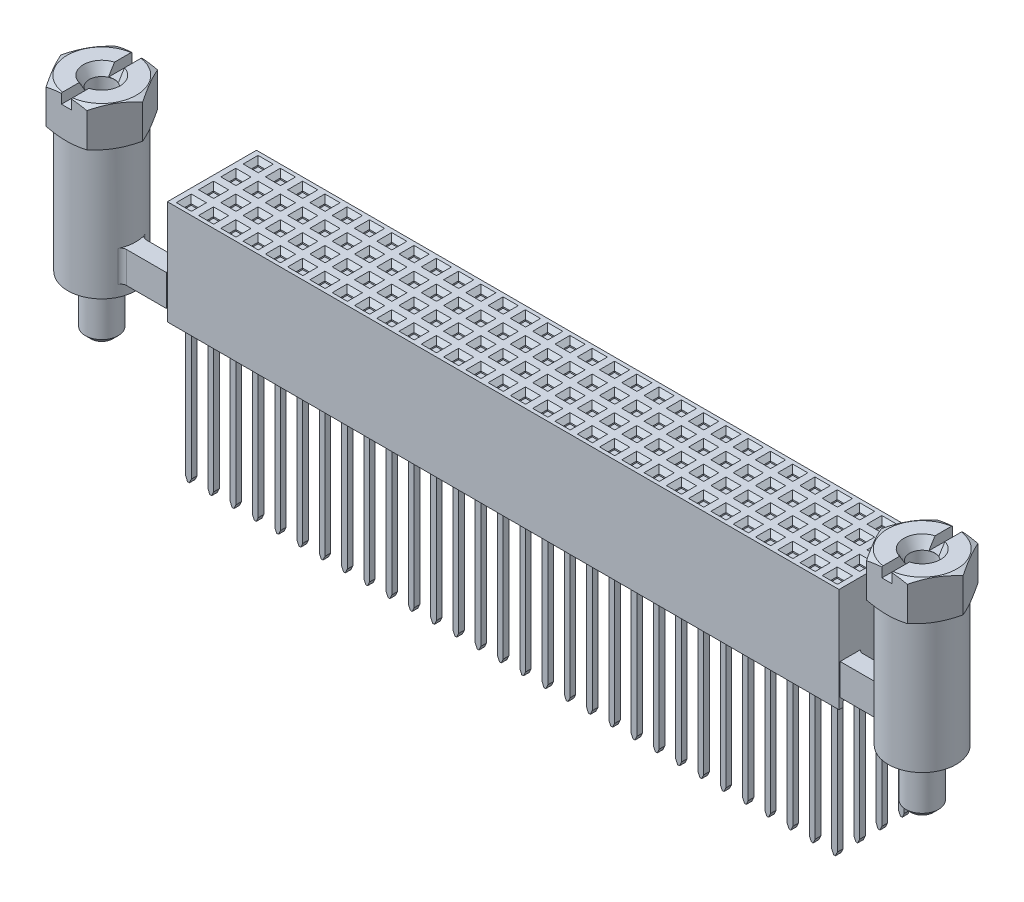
SolidWorks part; units mm, degrees
ref_plane "Front" through (0, 0, 0) normal (0, 0, 1) x (1, 0, 0)
ref_plane "Top" through (0, 0, 0) normal (0, 1, 0) x (1, 0, 0)
ref_plane "Right" through (0, 0, 0) normal (1, 0, 0) x (0, 0, -1)
imported_body "Импортированный1"
sketch "Эскиз1" plane through (0, 0, 7) normal (0, 0, 1) x (1, 0, 0)
  line L0 (-59.15, 3.8) -> (-62.8225, 3.8) construction
  line L1 (-59.15, 1) -> (-59.25, 1)
  line L2 (-59.15, 1) -> (-59.15, 3.8)
  line L3 (-59.15, 3.8) -> (-59.25, 3.8)
  line L4 (-59.25, 1) -> (-59.25, 3.8)
  line L5 (4.4025, 3.8) -> (1.15, 3.8) construction
  line L6 (1.15, 1) -> (1.25, 1)
  line L7 (1.15, 1) -> (1.15, 3.8)
  line L8 (1.15, 3.8) -> (1.25, 3.8)
  line L9 (1.25, 1) -> (1.25, 3.8)
  dimension "D1" = 0.1
  dimension "D2" = 0.1
extrude "Вытянуть1" cut sketch "Эскиз1" against normal through all
